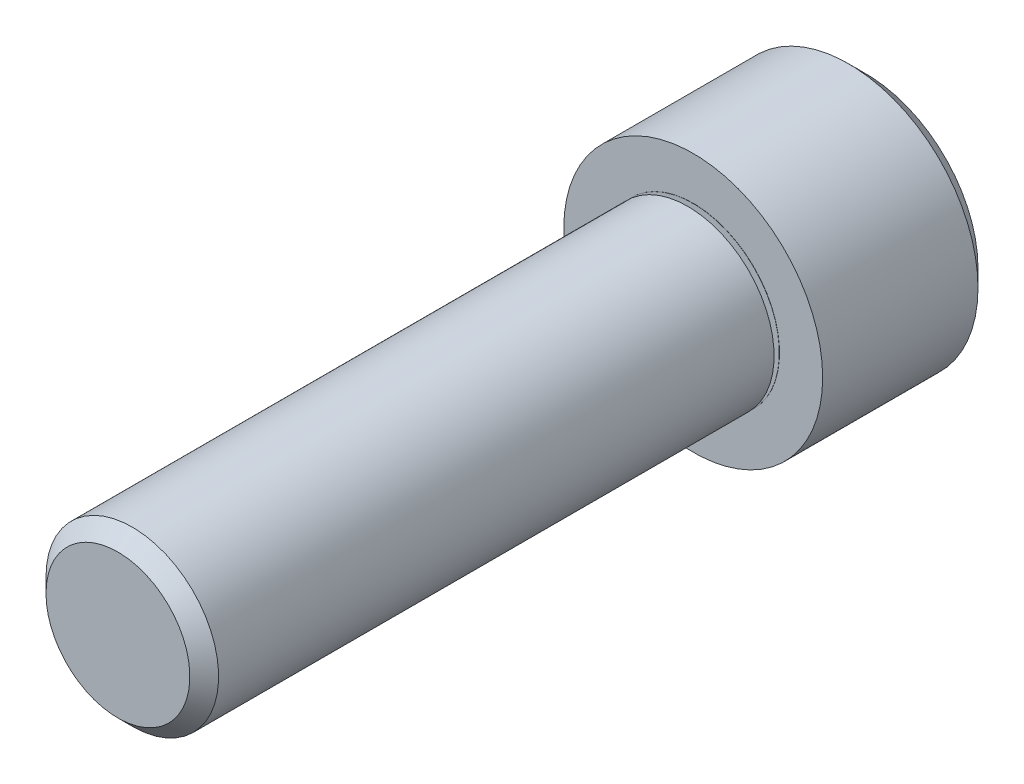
SolidWorks part; units mm, degrees
ref_plane "Front" through (0, 0, 0) normal (0, 0, 1) x (1, 0, 0)
ref_plane "Top" through (0, 0, 0) normal (0, 1, 0) x (1, 0, 0)
ref_plane "Right" through (0, 0, 0) normal (1, 0, 0) x (0, 0, -1)
sketch "Logo3_Revol_Axis" plane through (0, 0, 0) normal (0, 1, 0) x (1, 0, 0)
  line L0 (0, -43.5172) -> (0, 43.5172) construction
sketch "Logo3_bib1" plane through (0, 0, 0) normal (0, -1, 0) x (-1, 0, 0)
  line L0 (0, -31.75) -> (0, 9.525)
  line L1 (0, 9.525) -> (6.1913, 9.525)
  line L2 (7.1438, 8.5725) -> (7.1438, 0)
  line L3 (7.1438, 0) -> (4.7625, 0)
  line L4 (4.7625, 0) -> (4.7625, -0.01)
  line L5 (4.7625, -30.9563) -> (3.9688, -31.75)
  line L6 (3.9688, -31.75) -> (0, -31.75)
  line L7 (4.7625, -0.01) -> (4.0822, -0.01)
  line L8 (4.0753, -0.0488) -> (4.7625, -0.2989)
  line L9 (4.7625, -0.2989) -> (4.7625, -30.9563)
  line L10 (0, 10.5852) -> (0, -63.2873) construction
  line L11 (6.1913, 9.525) -> (7.1438, 8.5725)
  arc A1 (4.0822, -0.01) -> (4.0753, -0.0488) centre (4.0822, -0.03) ccw
  point P17 (3.9688, -0.01)
  point P19 (7.1438, 9.525)
revolve "Revolve1" add sketch "Logo3_bib1" angle 360 about L10
sketch "Logo3_bib2" plane through (0, 0, -9.525) normal (0, 0, -1) x (1, 0, 0)
  line L1 (4.5754, 0) -> (2.2877, 3.9624)
  line L2 (2.2877, 3.9624) -> (-2.2877, 3.9624)
  line L3 (-2.2877, 3.9624) -> (-4.5754, 0)
  line L4 (-4.5754, 0) -> (-2.2877, -3.9624)
  line L5 (-2.2877, -3.9624) -> (2.2877, -3.9624)
  line L6 (2.2877, -3.9624) -> (4.5754, 0)
  circle A0 centre (0, 0) radius 3.9624 construction
  dimension "Logo3_c1" = 7.9248
extrude "Cut-Extrude1" cut sketch "Logo3_bib2" against normal blind 4.7625
equation "\"DIA2@Logo3_bib1\" = \"Logo3_d1-pas@Logo3_bib1\""
equation "\"LGT1@Logo3_bib1\" = \"Logo3_d1@Logo3_bib1\""
equation "\"D1@Cut-Extrude1\" = \"Logo3_d1@Logo3_bib1\"/2."
equation "\"D2@Cosmetic Thread1\" = \"Logo3_d1-pas@Logo3_bib1\""
equation "\"D5@Logo3_bib1\"=\"Logo3_d1@Logo3_bib1\"*.1"
